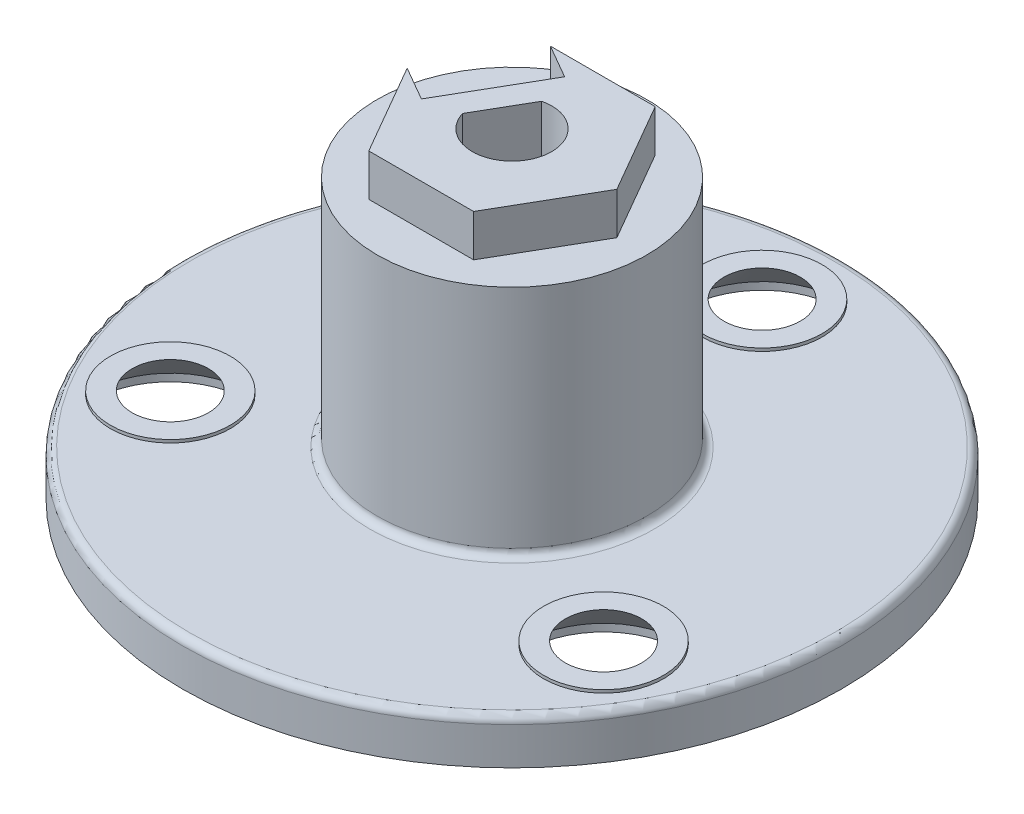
SolidWorks part; units mm, degrees
ref_plane "Спереди" through (0, 0, 0) normal (0, 0, 1) x (1, 0, 0)
ref_plane "Сверху" through (0, 0, 0) normal (0, 1, 0) x (1, 0, 0)
ref_plane "Справа" through (0, 0, 0) normal (1, 0, 0) x (0, 0, -1)
sketch "Эскиз1" plane through (0, 0, 0) normal (0, 1, 0) x (1, 0, 0)
  line L1 (-7.2313, 4.175) -> (0, 0) construction
  line L2 (0, 0) -> (2.295, -1.325) construction
  line L4 (-1.5696, 0.9062) -> (-0.6029, 2.5805)
  line L5 (-1.5696, 0.9062) -> (-2.5362, -0.7681)
  circle A0 centre (0, 0) radius 22
  arc A1 (-2.5362, -0.7681) -> (-0.6029, 2.5805) centre (0, 0) ccw
  circle A2 centre (0, 16.7) radius 2.5
  circle A3 centre (14.4626, -8.35) radius 2.5
  circle A4 centre (-14.4626, -8.35) radius 2.5
  point P12 (0, 0)
  dimension "D1" = 3
extrude "Бобышка-Вытянуть1" add sketch "Эскиз1" along normal blind 3
sketch "Эскиз2" plane through (0, 3, 0) normal (0, 1, 0) x (1, 0, 0)
  circle A0 centre (0, 16.7) radius 4
  circle A1 centre (14.4626, -8.35) radius 4
  circle A2 centre (-14.4626, -8.35) radius 4
  circle A3 centre (0, 16.7) radius 2.5
  circle A4 centre (-14.4626, -8.35) radius 2.5
  circle A5 centre (14.4626, -8.35) radius 2.5
extrude "Бобышка-Вытянуть2" add sketch "Эскиз2" along normal blind 0.2
sketch "Эскиз3" plane through (0, 3, 0) normal (0, 1, 0) x (1, 0, 0)
  line L0 (-2.5362, -0.7681) -> (-0.6029, 2.5805)
  circle A0 centre (0, 0) radius 9
  arc A1 (-2.5362, -0.7681) -> (-0.6029, 2.5805) centre (0, 0) ccw
extrude "Бобышка-Вытянуть3" add sketch "Эскиз3" along normal blind 15.4
sketch "Эскиз4" plane through (0, 18.4, 0) normal (0, 1, 0) x (1, 0, 0)
  line L0 (-2.5362, -0.7681) -> (-0.6029, 2.5805)
  line L1 (7, 0) -> (3.5, 6.0622)
  line L2 (3.5, 6.0622) -> (-3.5, 6.0622)
  line L3 (-3.5, 6.0622) -> (-7, 0)
  line L4 (-7, 0) -> (-3.5, -6.0622)
  line L5 (-3.5, -6.0622) -> (3.5, -6.0622)
  line L6 (3.5, -6.0622) -> (7, 0)
  circle A0 centre (0, 0) radius 6.0622 construction
  arc A1 (-2.5362, -0.7681) -> (-0.6029, 2.5805) centre (0, 0) ccw
  point P1 (7.0568, 0)
extrude "Бобышка-Вытянуть4" add sketch "Эскиз4" along normal blind 3
sketch "Эскиз5" plane through (0, 21.4, 0) normal (0, 1, 0) x (1, 0, 0)
  line L1 (-7, 0) -> (-3.5, 6.0622)
  line L2 (-3.5, 6.0622) -> (-1.2483, 4.7622)
  line L3 (-1.2483, 4.7622) -> (-4.7483, -1.3)
  line L4 (-4.7483, -1.3) -> (-7, 0)
extrude "Вырез-Вытянуть1" cut sketch "Эскиз5" against normal blind 15
sketch "Эскиз7" plane through (-2.9983, 0, -1.7311) normal (-0.866, 0, -0.5) x (-0.5, 0, 0.866)
  line L4 (1.5236, 10.0228) -> (0.7618, 11.3423)
  line L5 (0.7618, 11.3423) -> (-0.7618, 11.3423)
  line L6 (-0.7618, 11.3423) -> (-1.5236, 10.0228)
  line L7 (-1.5236, 10.0228) -> (-0.7618, 8.7033)
  line L8 (-0.7618, 8.7033) -> (0.7618, 8.7033)
  line L9 (0.7618, 8.7033) -> (1.5236, 10.0228)
  circle A0 centre (0, 10.0228) radius 1.3195 construction
extrude "Вырез-Вытянуть2" cut sketch "Эскиз7" along normal blind 12 and the other way blind 4
sketch "Эскиз9" plane through (0, 18.4, 0) normal (0, 1, 0) x (1, 0, 0)
  line L7 (7, 0) -> (3.5, 6.0622)
  line L8 (3.5, 6.0622) -> (-3.5, 6.0622)
  line L9 (-3.5, 6.0622) -> (-7, 0)
  line L10 (-7, 0) -> (-3.5, -6.0622)
  line L11 (-3.5, -6.0622) -> (3.5, -6.0622)
  line L12 (3.5, -6.0622) -> (7, 0)
  circle A0 centre (0, 0) radius 6.0622 construction
  circle A5 centre (0, 0) radius 9
extrude "Бобышка-Вытянуть5" add sketch "Эскиз9" along normal blind 0.2
hole_wizard "Зенковка для  винта с потайной головкой с внутренним шестигранником M51" positions "Эскиз13" profile "Эскиз14" countersink size "M5" standard "Ansi Metric"
sketch "Эскиз13" plane through (0, 0, 0) normal (0, -1, 0) x (-1, 0, 0)
  point P0 (-14.4626, -8.35)
  point P3 (14.4626, -8.35)
  point P6 (0, 16.7)
sketch "Эскиз14" plane through (14.4626, 0, 8.35) normal (1, 0, 0) x (0, 0, -1)
  line L0 (0, 0) -> (0, 21.4)
  line L1 (0, 21.4) -> (2.5, 21.4)
  line L2 (2.5, 21.4) -> (2.5, 3.25)
  line L3 (2.5, 3.25) -> (5.25, 0.5)
  line L4 (5.25, 0.5) -> (5.25, 0)
  line L6 (5.25, 0) -> (0, 0)
  line L7 (-2.5, 3.25) -> (-5.25, 0.5) construction
  line L11 (0, -6.35) -> (0, 107.95) construction
  dimension "Диаметр сквозного отверстия" = 5
  dimension "Глубина сквозного отверстия" = 21.4
  dimension "Диаметр зенковки" = 10.5
  dimension "Угол зенковки" = 90
  dimension "Утопленность" = 0.5
fillet "Скругление1" radius 0.5 2 edges at (0, 3, 22) (0, 3, 9)
